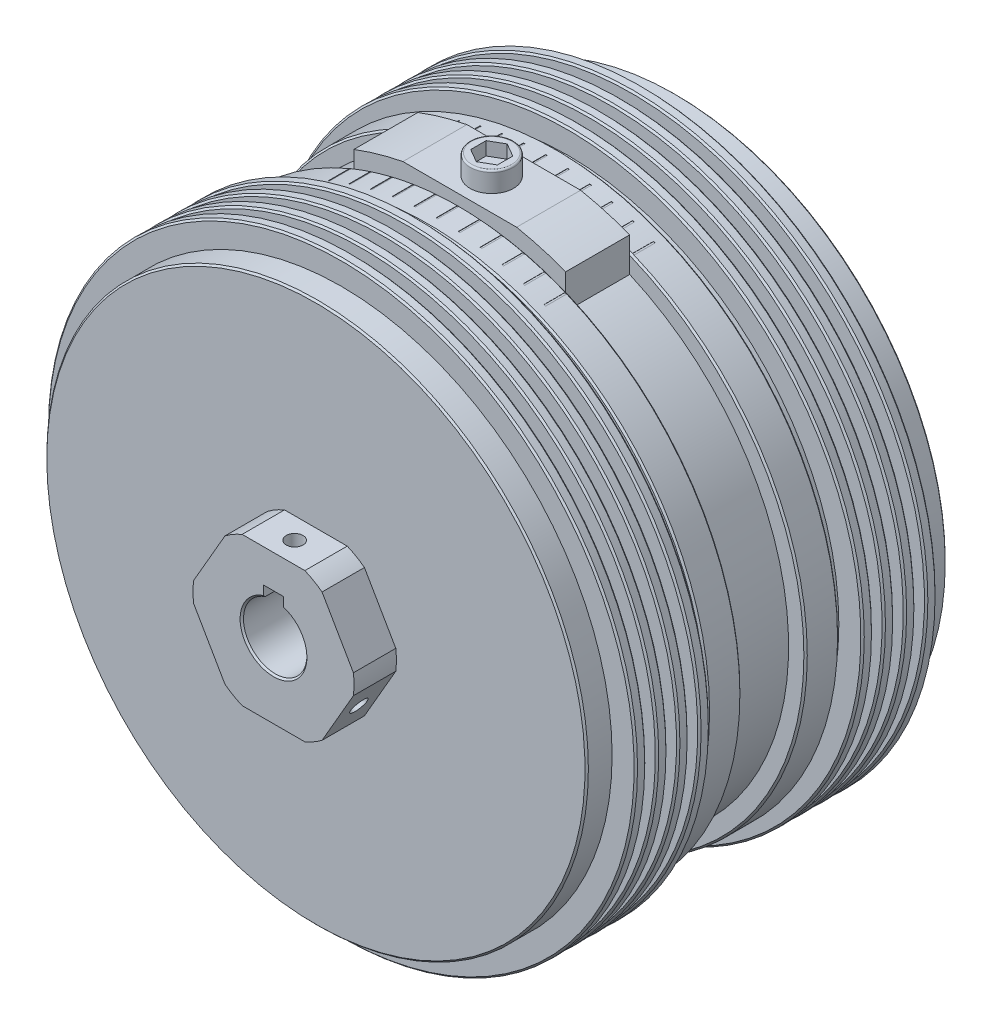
SolidWorks part; units mm, degrees
ref_plane "Front Plane" through (0, 0, 0) normal (0, 0, 1) x (1, 0, 0)
ref_plane "Top Plane" through (0, 0, 0) normal (0, 1, 0) x (1, 0, 0)
ref_plane "Right Plane" through (0, 0, 0) normal (1, 0, 0) x (0, 0, -1)
sketch "Sketch1" plane through (0, 0, 0) normal (1, 0, 0) x (0, 0, -1)
  line L0 (0, 0) -> (154.6696, 0) construction
  line L1 (0, 0) -> (0, 9.4996) construction
  line L2 (0, 24.13) -> (12.7, 24.13)
  line L3 (131.2418, 28.956) -> (131.2418, 19.812)
  line L4 (12.7, 24.13) -> (12.7, 81.153)
  line L5 (12.7, 81.153) -> (20.32, 81.153)
  line L6 (20.32, 81.153) -> (20.32, 88.265)
  line L7 (20.32, 88.265) -> (23.495, 88.265)
  line L8 (45.72, 84.455) -> (45.72, 81.153)
  line L9 (26.67, 88.265) -> (29.845, 88.265)
  line L10 (33.02, 88.265) -> (36.195, 88.265)
  line L11 (45.72, 84.455) -> (55.8165, 84.455)
  line L12 (55.8165, 84.455) -> (55.8165, 79.375)
  line L13 (55.8165, 79.375) -> (74.9935, 79.375)
  line L14 (74.9935, 79.375) -> (74.9935, 84.455)
  line L15 (74.9935, 84.455) -> (85.09, 84.455)
  line L16 (107.315, 88.265) -> (107.315, 81.153)
  line L17 (107.315, 81.153) -> (104.14, 81.153)
  line L18 (131.2418, 19.812) -> (134.112, 19.812)
  line L19 (88.265, 88.265) -> (91.44, 88.265)
  line L20 (110.49, 88.265) -> (110.49, 81.153)
  line L21 (110.49, 81.153) -> (120.65, 81.153)
  line L22 (120.65, 81.153) -> (120.65, 41.656)
  line L23 (121.031, 41.275) -> (123.698, 41.275)
  line L24 (123.698, 41.275) -> (123.698, 28.956)
  line L25 (123.698, 28.956) -> (131.2418, 28.956)
  line L28 (134.112, 19.812) -> (134.112, 9.4996)
  line L29 (134.112, 9.4996) -> (0, 9.4996)
  line L30 (23.495, 88.265) -> (23.495, 81.153)
  line L31 (23.495, 81.153) -> (26.67, 81.153)
  line L32 (26.67, 81.153) -> (26.67, 88.265)
  line L33 (29.845, 88.265) -> (29.845, 81.153)
  line L34 (29.845, 81.153) -> (33.02, 81.153)
  line L35 (33.02, 81.153) -> (33.02, 88.265)
  line L36 (36.195, 88.265) -> (36.195, 81.153)
  line L37 (36.195, 81.153) -> (39.37, 81.153)
  line L38 (39.37, 81.153) -> (39.37, 88.265)
  line L39 (42.545, 88.265) -> (42.545, 81.153)
  line L40 (39.37, 88.265) -> (42.545, 88.265)
  line L41 (42.545, 81.153) -> (45.72, 81.153)
  line L42 (104.14, 81.153) -> (104.14, 88.265)
  line L43 (107.315, 88.265) -> (110.49, 88.265)
  line L44 (100.965, 88.265) -> (100.965, 81.153)
  line L45 (100.965, 81.153) -> (97.79, 81.153)
  line L46 (97.79, 81.153) -> (97.79, 88.265)
  line L47 (100.965, 88.265) -> (104.14, 88.265)
  line L48 (94.615, 88.265) -> (94.615, 81.153)
  line L49 (94.615, 81.153) -> (91.44, 81.153)
  line L50 (91.44, 81.153) -> (91.44, 88.265)
  line L51 (94.615, 88.265) -> (97.79, 88.265)
  line L52 (88.265, 88.265) -> (88.265, 81.153)
  line L53 (88.265, 81.153) -> (85.09, 81.153)
  line L54 (85.09, 81.153) -> (85.09, 84.455)
  line L59 (0, 24.13) -> (0, 9.4996)
  arc A0 (121.031, 41.275) -> (120.65, 41.656) centre (121.031, 41.656) cw
  dimension "D35" = 0.381
  dimension "D2" = 176.53
  dimension "D4" = 18.9992
  dimension "D5" = 158.75
  dimension "D6" = 168.91
  dimension "D7" = 57.912
  dimension "D8" = 107.95
  dimension "D9" = 13.462
  dimension "D10" = 82.55
  dimension "D11" = 3.048
  dimension "D12" = 134.112
  dimension "D13" = 19.177
  dimension "D14" = 7.62
  dimension "D15" = 25.4
  dimension "D16" = 3.175
  dimension "D17" = 3.175
  dimension "D18" = 3.175
  dimension "D19" = 3.175
  dimension "D20" = 3.175
  dimension "D21" = 3.175
  dimension "D22" = 3.175
  dimension "D23" = 3.175
  dimension "D24" = 7.112
  dimension "D25" = 3.175
  dimension "D26" = 3.175
  dimension "D27" = 90.17
  dimension "D28" = 3.175
  dimension "D29" = 3.175
  dimension "D30" = 3.175
  dimension "D31" = 3.175
  dimension "D32" = 3.175
  dimension "D33" = 48.26
  dimension "D34" = 35.4965
  dimension "D37" = 2.8702
  dimension "D36" = 39.624
revolve "Revolve1" add sketch "Sketch1" angle 360 about L0
chamfer "Chamfer1" distance 0.508 angle 45 23 edges at (88.265, 0, -110.49) (88.265, 0, -107.315) (88.265, 0, -104.14) (88.265, 0, -100.965) (88.265, 0, -97.79) (88.265, 0, -94.615) (88.265, 0, -91.44) (88.265, 0, -88.265) (84.455, 0, -85.09) (84.455, 0, -74.9935) (84.455, 0, -55.8165) (84.455, 0, -45.72) (88.265, 0, -42.545) (88.265, 0, -39.37) (88.265, 0, -36.195) (88.265, 0, -33.02) (88.265, 0, -29.845) (88.265, 0, -26.67) (88.265, 0, -23.495) (88.265, 0, -20.32) (41.275, 0, -123.698) (9.4996, 0, 0) (9.4996, 0, -134.112)
ref_plane "Plane1" through (0, 0, -55.8165) normal (0, 0, -1) x (-1, 0, 0)
sketch "Sketch4" plane through (0, 0, -55.8165) normal (0, 0, -1) x (-1, 0, 0)
  line L0 (0, 79.375) -> (0, 93.3454) construction
  line L1 (31.75, 72.7484) -> (31.75, 83.037)
  line L2 (-31.75, 72.7484) -> (-31.75, 83.037)
  line L3 (-31.75, 79.375) -> (-31.75, 93.3454) construction
  line L4 (31.75, 79.375) -> (31.75, 93.3454) construction
  line L5 (0, 87.2518) -> (17.0392, 87.2518)
  line L6 (0, 87.2518) -> (-17.0392, 87.2518)
  circle A0 centre (0, 0) radius 79.375 construction
  circle A1 centre (0, 0) radius 79.375
  arc A2 (31.75, 83.037) -> (17.0392, 87.2518) centre (0, 0) ccw
  arc A3 (-17.0392, 87.2518) -> (-31.75, 83.037) centre (0, 0) ccw
  dimension "D1" = 177.8
  dimension "D4" = 14.5034
  dimension "D2" = 31.75
  dimension "D3" = 31.75
extrude "Boss-Extrude1" add sketch "Sketch4" along normal up to surface (19.177 mm away) contours L6 A3 L2 A1 L1 A2 L5
sketch "Sketch5" plane through (0, 87.2518, 0) normal (0, 1, 0) x (1, 0, 0)
  line L0 (0, 55.8165) -> (0, 74.9935) construction
  line L1 (-17.0392, 55.8165) -> (17.0392, 55.8165) construction
  line L3 (31.75, 74.9935) -> (-31.75, 74.9935) construction
  circle A0 centre (0, 65.405) radius 6.5024
  dimension "D1" = 13.0048
extrude "Boss-Extrude2" add sketch "Sketch5" along normal blind 5.9944
sketch "Sketch6" plane through (0, 93.2462, 0) normal (0, 1, 0) x (-1, 0, 0)
  line L0 (0, -65.405) -> (0, -60.7856) construction
  line L1 (-4.0005, -63.0953) -> (-4.0005, -67.7147)
  line L2 (-4.0005, -67.7147) -> (0, -70.0244)
  line L3 (0, -70.0244) -> (4.0005, -67.7147)
  line L4 (4.0005, -67.7147) -> (4.0005, -63.0953)
  line L5 (4.0005, -63.0953) -> (0, -60.7856)
  line L6 (0, -60.7856) -> (-4.0005, -63.0953)
  circle A0 centre (0, -65.405) radius 4.0005 construction
  dimension "D1" = 8.001
extrude "Cut-Extrude3" cut sketch "Sketch6" against normal blind 3.9878
fillet "Fillet2" radius 0.508 1 edges at (0, 93.2462, -58.9026)
pattern_circular "CirPattern2" count 2 over 360 about axis through (0, 0, 0) along (0, 0, 1) of "Fillet2", "Cut-Extrude3", "Boss-Extrude2", "Boss-Extrude1"
chamfer "Chamfer3" distance 0.508 angle 45 2 edges at (81.153, 0, -120.65) (81.153, 0, -12.7)
ref_plane "Plane2" through (0, 84.455, 0) normal (0, 1, 0) x (-1, 0, 0)
sketch "Sketch19" plane through (0, 84.455, 0) normal (0, 1, 0) x (-1, 0, 0)
  line L0 (0, -74.9935) -> (0, -84.582) construction
  line L1 (83.947, -74.9935) -> (-83.947, -74.9935) construction
  line L2 (-84.455, -84.582) -> (84.455, -84.582) construction
  line L3 (0, -46.228) -> (0, -55.3085) construction
  line L4 (84.455, -46.228) -> (-84.455, -46.228) construction
  line L5 (-84.455, -55.3085) -> (84.455, -55.3085) construction
  line L6 (-0.254, -48.9585) -> (-0.254, -55.3085)
  line L7 (-0.254, -75.5015) -> (-0.254, -81.8015)
  line L8 (0.254, -48.9585) -> (0.254, -55.3085)
  line L9 (0.254, -75.5015) -> (0.254, -81.8015)
  line L10 (-0.254, -55.3085) -> (0.254, -55.3085)
  line L11 (-0.254, -48.9585) -> (0.254, -48.9585)
  line L12 (-0.254, -46.228) -> (-0.254, -55.3085) construction
  line L13 (0.254, -46.228) -> (0.254, -55.3085) construction
  line L14 (-0.254, -74.9935) -> (-0.254, -84.582) construction
  line L15 (84.455, -75.5015) -> (-84.455, -75.5015) construction
  line L16 (0.254, -74.9935) -> (0.254, -84.582) construction
  line L17 (-0.254, -75.5015) -> (0.254, -75.5015)
  line L18 (-0.254, -81.8015) -> (0.254, -81.8015)
  dimension "D3" = 6.35
  dimension "D4" = 6.3
  dimension "D1" = 0.254
  dimension "D2" = 0.254
extrude "Cut-Extrude10" cut sketch "Sketch19" against normal blind 0.1016
pattern_circular "CirPattern8" count 6 over 22.5 about axis through (0, 0, 0) along (0, 0, 1) of "Cut-Extrude10"
pattern_circular "CirPattern9" count 6 over 22.5 about axis through (0, 0, 0) along (0, 0, 1) of "Cut-Extrude10"
hole_wizard "M8x1.25 Tapped Hole1" positions "Sketch21" profile "Sketch20" tap size "M8x1.25" standard "ANSI Metric"
sketch "Sketch21" plane through (0, 0, -120.65) normal (0, 0, -1) x (-1, 0, 0)
  line L0 (0, 0) -> (0, 50.8) construction
  point P0 (0, 50.8)
  dimension "D1" = 50.8
sketch "Sketch20" plane through (0, 50.8, -120.65) normal (1, 0, 0) x (0, 1, 0)
  line L0 (0, 0) -> (0, 18.8069)
  line L1 (0, 18.8069) -> (3.4, 16.764)
  line L2 (3.4, 16.764) -> (3.4, 0)
  line L5 (3.4, 0) -> (0, 0)
  line L10 (0, 18.8069) -> (-3.4, 16.764) construction
  line L11 (0, -6.35) -> (0, 107.95) construction
  dimension "Tap Drill Dia." = 6.8
  dimension "Tap Drill Depth" = 16.764
  dimension "Drill Angle" = 118
pattern_circular "CirPattern10" count 3 over 360 about axis through (0, 0, 0) along (0, 0, 1) of "M8x1.25 Tapped Hole1"
sketch "Sketch22" plane through (0, 0, 0) normal (0, 0, 1) x (1, 0, 0)
  line L0 (0, 0) -> (0, 22.225) construction
  line L1 (-12.8316, 22.225) -> (-25.6632, 0)
  line L2 (-25.6632, 0) -> (-12.8316, -22.225)
  line L3 (-12.8316, -22.225) -> (12.8316, -22.225)
  line L4 (12.8316, -22.225) -> (25.6632, 0)
  line L5 (25.6632, 0) -> (12.8316, 22.225)
  line L6 (12.8316, 22.225) -> (-12.8316, 22.225)
  circle A0 centre (0, 0) radius 22.225 construction
  dimension "D1" = 44.45
extrude "Cut-Extrude11" cut sketch "Sketch22" against normal blind 12.7 flip side to cut
sketch "Sketch23" plane through (0, 0, 0) normal (0, 0, 1) x (1, 0, 0)
  line L0 (0, 0) -> (0, 6.2941) construction
  line L1 (0, 6.2941) -> (2.9997, 6.2941)
  line L2 (2.9997, 6.2941) -> (2.9997, 12.2936)
  line L3 (2.9997, 12.2936) -> (-2.9997, 12.2936)
  line L4 (-2.9997, 12.2936) -> (-2.9997, 6.2941)
  line L5 (-2.9997, 6.2941) -> (0, 6.2941)
  circle A0 centre (0, 0) radius 9.4996 construction
  dimension "D1" = 5.9995
  dimension "D2" = 5.9995
  dimension "D3" = 21.7932
extrude "Cut-Extrude12" cut sketch "Sketch23" against normal through all
hole_wizard "M6x1.0 Tapped Hole1" positions "Sketch25" profile "Sketch24" tap size "M6x1.0" standard "ANSI Metric"
sketch "Sketch25" plane through (19.2474, -11.1125, 0) normal (0.866, -0.5, 0) x (0, 0, -1)
  line L0 (0, 0) -> (6.35, 0) construction
  point P0 (6.35, 0)
  dimension "D1" = 6.35
sketch "Sketch24" plane through (19.2474, -11.1125, -6.35) normal (0, 0, 1) x (0.5, 0.866, 0)
  line L0 (0, 0) -> (0, 44.45)
  line L1 (0, 44.45) -> (2.5, 44.45)
  line L2 (2.5, 44.45) -> (2.5, 0)
  line L5 (2.5, 0) -> (0, 0)
  line L11 (0, -6.35) -> (0, 107.95) construction
  dimension "Thru Tap Drill Dia." = 5
  dimension "Thru Tap Drill Depth" = 44.45
pattern_circular "CirPattern11" count 2 over 120 about axis through (0, 0, 0) along (0, 0, 1) of "M6x1.0 Tapped Hole1"
sketch "Sketch26" plane through (0, 0, -134.112) normal (0, 0, -1) x (-1, 0, 0)
  line L0 (0, -28.956) -> (0, 28.956) construction
  line L1 (-28.956, 0) -> (28.956, 0) construction
  line L2 (3.175, -28.7814) -> (3.175, -26.3144)
  line L3 (-28.7814, -3.175) -> (-26.3144, -3.175)
  line L4 (-3.175, -28.7814) -> (-3.175, -26.3144)
  line L5 (-28.7814, 3.175) -> (-26.3144, 3.175)
  line L6 (-28.956, 3.175) -> (28.956, 3.175) construction
  line L7 (-28.956, -3.175) -> (28.956, -3.175) construction
  line L8 (-3.175, -28.956) -> (-3.175, 28.956) construction
  line L9 (3.175, -28.956) -> (3.175, 28.956) construction
  line L10 (-3.175, 26.3144) -> (3.175, 26.3144)
  line L11 (-3.175, 26.3144) -> (-3.175, 28.7814)
  line L12 (3.175, 26.3144) -> (3.175, 28.7814)
  line L13 (-26.3144, -3.175) -> (-26.3144, 3.175)
  line L14 (26.3144, -3.175) -> (26.3144, 3.175)
  line L15 (-3.175, -26.3144) -> (3.175, -26.3144)
  line L18 (26.3144, 3.175) -> (28.7814, 3.175)
  line L19 (26.3144, -3.175) -> (28.7814, -3.175)
  circle A0 centre (0, 0) radius 28.956 construction
  arc A1 (-28.7814, 3.175) -> (-28.7814, -3.175) centre (0, 0) ccw
  arc A2 (3.175, 28.7814) -> (-3.175, 28.7814) centre (0, 0) ccw
  arc A3 (-3.175, -28.7814) -> (3.175, -28.7814) centre (0, 0) ccw
  arc A4 (28.7814, -3.175) -> (28.7814, 3.175) centre (0, 0) ccw
  dimension "D3" = 2.6416
  dimension "D4" = 2.6416
  dimension "D5" = 2.6416
  dimension "D6" = 2.6416
  dimension "D1" = 3.175
  dimension "D2" = 3.175
extrude "Cut-Extrude13" cut sketch "Sketch26" against normal up to surface (10.414 mm away)
